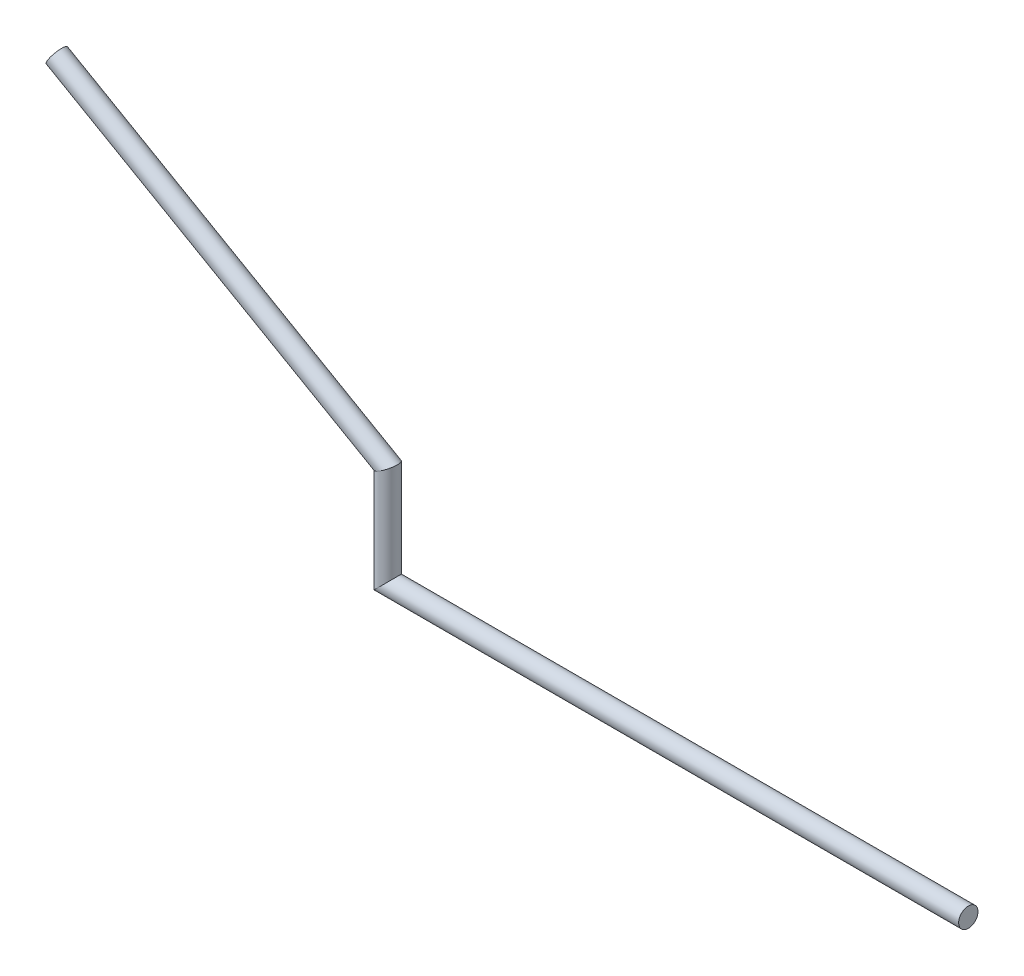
SolidWorks part; units mm, degrees
ref_plane "Front Plane" through (0, 0, 0) normal (0, 0, 1) x (1, 0, 0)
ref_plane "Top Plane" through (0, 0, 0) normal (0, 1, 0) x (1, 0, 0)
ref_plane "Right Plane" through (0, 0, 0) normal (1, 0, 0) x (0, 0, -1)
sketch "Sketch2" plane through (0, 0, 0) normal (0, 0, 1) x (1, 0, 0)
  line L0 (0, 0) -> (-76.2, 0)
  line L1 (-76.2, 0) -> (-76.2, 13.2301)
  line L2 (-76.2, 13.2301) -> (-119.6438, 38.1564)
  dimension "D1" = 76.2
sketch "Sketch3" plane through (0, 0, 0) normal (1, 0, 0) x (0, 0, -1)
  circle A0 centre (0, 0) radius 1.27
  dimension "D1" = 2.54
sweep "Sweep1" add profiles "Sketch3" path "Sketch2"
